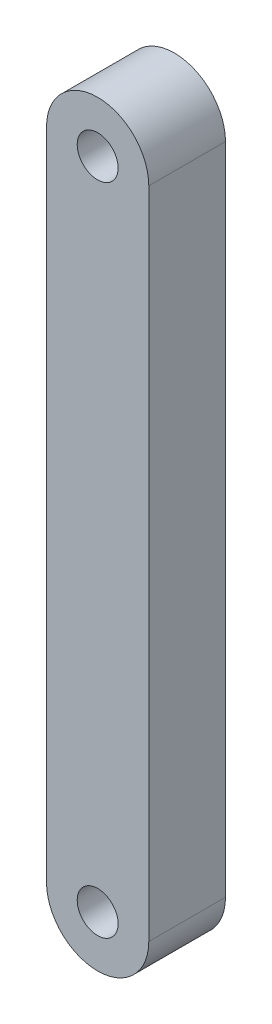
SolidWorks part; units mm, degrees
ref_plane "Front Plane" through (0, 0, 0) normal (0, 0, 1) x (1, 0, 0)
ref_plane "Top Plane" through (0, 0, 0) normal (0, 1, 0) x (1, 0, 0)
ref_plane "Right Plane" through (0, 0, 0) normal (1, 0, 0) x (0, 0, -1)
sketch "Sketch1" plane through (0, 0, 0) normal (0, 0, 1) x (1, 0, 0)
  line L2 (-6.35, -40.64) -> (-6.35, 40.64)
  line L4 (6.35, -40.64) -> (6.35, 40.64)
  line L5 (-6.35, -40.64) -> (6.35, 40.64) construction
  line L6 (-6.35, 40.64) -> (6.35, -40.64) construction
  arc A0 (6.35, 40.64) -> (-6.35, 40.64) centre (0, 40.64) ccw
  arc A1 (6.35, -40.64) -> (-6.35, -40.64) centre (0, -40.64) cw
  circle A2 centre (0, 40.64) radius 2.54
  circle A3 centre (0, -40.64) radius 2.54
  point P0 (0, 0)
  dimension "D3" = 5.08
  dimension "D4" = 5.08
  dimension "D1" = 81.28
  dimension "D2" = 12.7
extrude "Boss-Extrude1" add sketch "Sketch1" along normal blind 9.525
